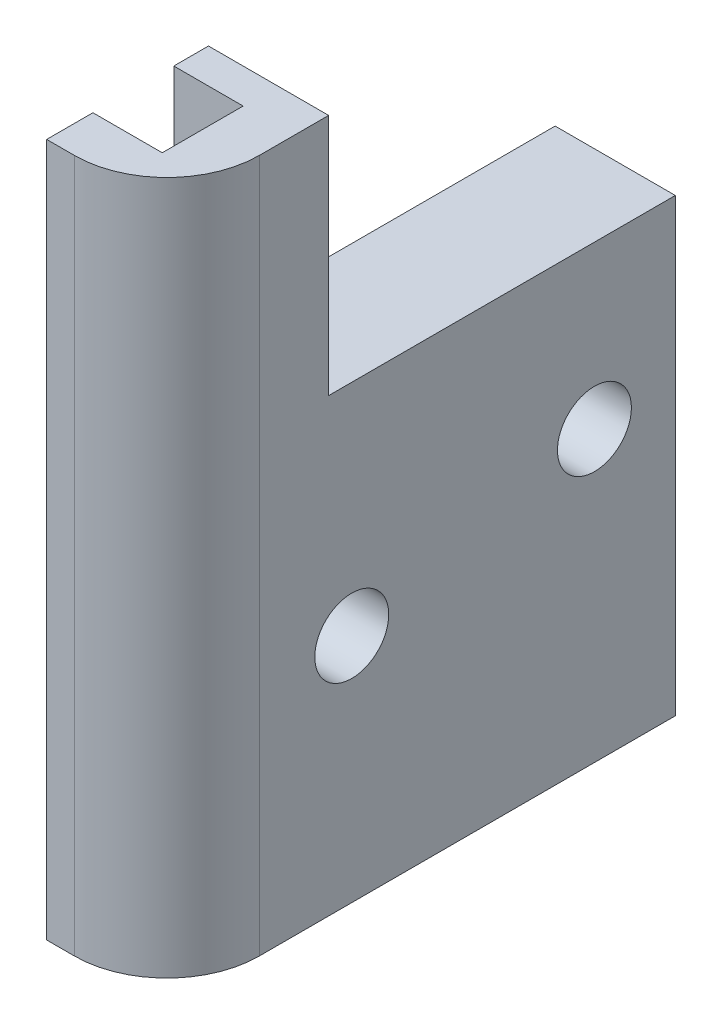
SolidWorks part; units mm, degrees
ref_plane "Plano frontal" through (0, 0, 0) normal (0, 0, 1) x (1, 0, 0)
ref_plane "Plano superior" through (0, 0, 0) normal (0, 1, 0) x (1, 0, 0)
ref_plane "Plano direito" through (0, 0, 0) normal (1, 0, 0) x (0, 0, -1)
sketch "Esboço1" plane through (0, 0, 0) normal (1, 0, 0) x (0, 0, -1)
  line L0 (0, 0) -> (-22, 0)
  line L1 (-22, 0) -> (-22, 30)
  line L2 (-22, 30) -> (-15, 30)
  line L3 (-15, 30) -> (-15, 19.5)
  line L4 (-15, 19.5) -> (0, 19.5)
  line L5 (0, 19.5) -> (0, 0)
  dimension "D1" = 19.5
  dimension "D2" = 30
  dimension "D3" = 7
  dimension "D4" = 15
extrude "Ressalto-extrusão1" add sketch "Esboço1" along normal blind 5.2
sketch "Esboço2" plane through (0, 0, 0) normal (-1, 0, 0) x (0, 0, 1)
  line L0 (16.5, 30) -> (16.5, 6)
  line L1 (15, 30) -> (22, 30) construction
  line L4 (5.4875, 1.3) -> (16.5, 2.5)
  line L5 (16.5, 2.5) -> (20, 2.5)
  line L6 (20, 2.5) -> (20, 30)
  line L7 (20, 30) -> (16.5, 30)
  line L8 (6.6786, 9.9487) -> (16.5, 6)
  line L9 (22, 0) -> (0, 0) construction
  line L12 (22, 30) -> (22, 0) construction
  line L15 (0.5, 5.7735) -> (0.5, 14.1468) construction
  line L16 (0, 0) -> (0, 19.5) construction
  line L17 (0.5, 5.7735) -> (12.9809, 5.7735) construction
  arc A1 (6.6786, 9.9487) -> (5.4875, 1.3) centre (5, 5.7735) ccw
  dimension "D1" = 27.5
  dimension "D4" = 4.5
  dimension "D6" = 0.5
  dimension "D2" = 3.5
  dimension "D3" = 3.5
  dimension "D5" = 1.3
  dimension "D7" = 2
extrude "Corte-extrusão1" cut sketch "Esboço2" against normal blind 3
fillet "Filete1" radius 3 2 edges at (1.5, 6, 16.5) (1.5, 2.5, 20)
sketch "Esboço3" plane through (3, 0, 0) normal (-1, 0, 0) x (0, 0, 1)
  line L0 (5.4875, 1.3) -> (16.5, 2.5) construction
  line L1 (12.3809, 7.6561) -> (6.6786, 9.9487) construction
  line L2 (5.4875, 1.3) -> (14.5118, 2.2833)
  line L3 (12.3809, 7.6561) -> (6.6786, 9.9487)
  line L4 (13.9463, 7.4729) -> (14.5118, 2.2833)
  arc A0 (12.3809, 7.6561) -> (16.5, 10.4395) centre (13.5, 10.4395) ccw construction
  arc A1 (6.6786, 9.9487) -> (5.4875, 1.3) centre (5, 5.7735) ccw construction
  arc A2 (12.3809, 7.6561) -> (13.9463, 7.4729) centre (13.5, 10.4395) ccw
  arc A3 (6.6786, 9.9487) -> (5.4875, 1.3) centre (5, 5.7735) ccw
  dimension "D1" = 2
extrude "Corte-extrusão2" cut sketch "Esboço3" against normal blind 1.3
chamfer "Chanfro1" distance 1.5 angle 60 2 edges at (3, 4.8781, 14.229) (4.3, 4.8781, 14.229)
sketch "Esboço4" plane through (5.2, 0, 0) normal (1, 0, 0) x (0, 0, -1)
  line L0 (0, 0) -> (0, 19.5) construction
  line L1 (-22, 0) -> (0, 0) construction
  circle A0 centre (-14, 10) radius 1.6
  circle A1 centre (-3.5, 12.5) radius 1.6
  dimension "D1" = 3.2
  dimension "D2" = 3.5
  dimension "D3" = 14
  dimension "D4" = 10
  dimension "D5" = 12.5
extrude "Corte-extrusão3" cut sketch "Esboço4" against normal up to next
fillet "Filete2" radius 4 1 edges at (5.2, 15, 22)
